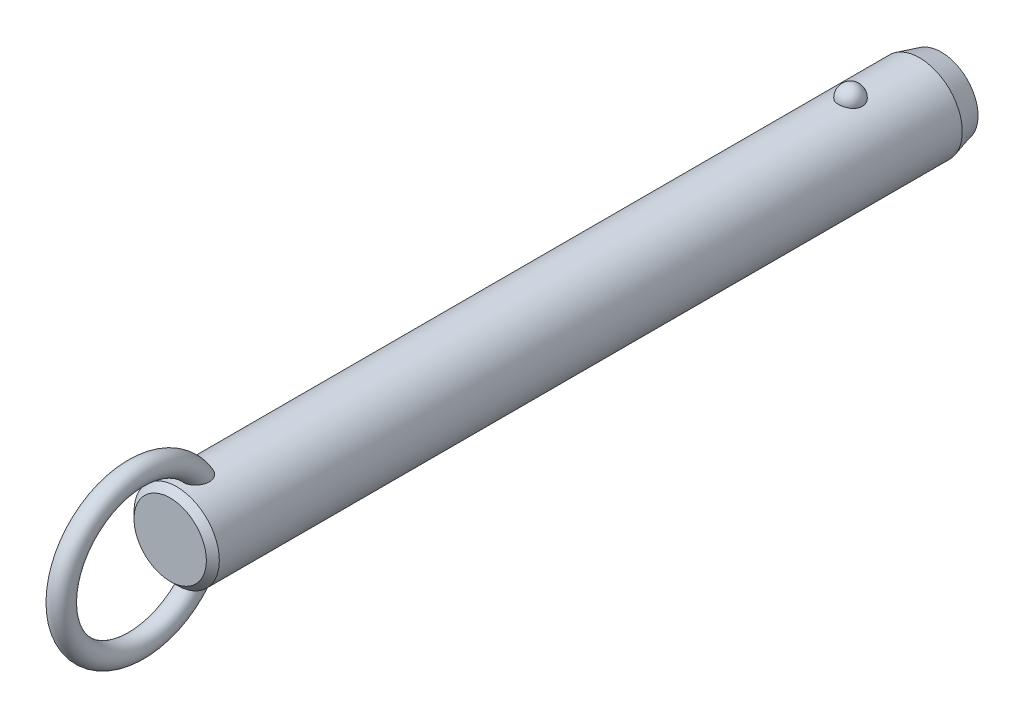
SolidWorks part; units mm, degrees
ref_plane "Front Plane" through (0, 0, 0) normal (0, 0, 1) x (1, 0, 0)
ref_plane "Top Plane" through (0, 0, 0) normal (0, 1, 0) x (1, 0, 0)
ref_plane "Right Plane" through (0, 0, 0) normal (1, 0, 0) x (0, 0, -1)
sketch "Sketch2" plane through (0, 0, 0) normal (0, 0, 1) x (1, 0, 0)
  circle A0 centre (0, 0) radius 7.9
  point P3 (0, 7.9)
  dimension "D1" = 15.8
extrude "Boss-Extrude1" add sketch "Sketch2" along normal blind 114.3
sketch "Sketch3" plane through (0, 0, 0) normal (0, 0, -1) x (-1, 0, 0)
  circle A0 centre (0, 0) radius 7.9
  dimension "D1" = 15.8
extrude "Boss-Extrude2" add sketch "Sketch3" along normal blind 19
chamfer "Chamfer1" distance 4 angle 15 1 edges at (-7.9, 0, -19)
sketch "Sketch12" plane through (0, 0, 0) normal (1, 0, 0) x (0, 0, -1)
  line L0 (-114.3, 7.9) -> (-114.3, -7.9) construction
  point P0 (-114.3, 0)
sketch "Sketch13" plane through (0, 0, 0) normal (1, 0, 0) x (0, 0, -1)
  circle A0 centre (-130.15, 0) radius 15.85
  point P2 (-114.3, 0)
  dimension "D1" = 31.7
sketch "Sketch14" plane through (0, 0, 0) normal (0, 1, 0) x (1, 0, 0)
  circle A0 centre (0, -116.3) radius 2
  point P2 (0, -114.3)
  dimension "D1" = 4
sweep "Sweep1" add profiles "Sketch14" path "Sketch13"
sketch "Sketch15" plane through (0, 0, 114.3) normal (0, 0, 1) x (1, 0, 0)
  circle A0 centre (0, 0) radius 7.9
  dimension "D1" = 15.8
extrude "Boss-Extrude3" add sketch "Sketch15" along normal blind 9.52
chamfer "Chamfer2" distance 1.2 angle 45 1 edges at (7.9, 0, 123.82)
sketch "Sketch18" plane through (0, 0, 0) normal (1, 0, 0) x (0, 0, -1)
  line L0 (15, 7.9) -> (-116.4091, 7.9) construction
  line L1 (2.2, 10.1) -> (2.2, 5.7)
  line L2 (-116.4091, -7.9) -> (15, -7.9) construction
  arc A0 (2.2, 10.1) -> (2.2, 5.7) centre (2.2, 7.9) ccw
  point P4 (0, 7.9)
  dimension "D1" = 18
revolve "Revolve1" add sketch "Sketch18" angle 360 about L1
